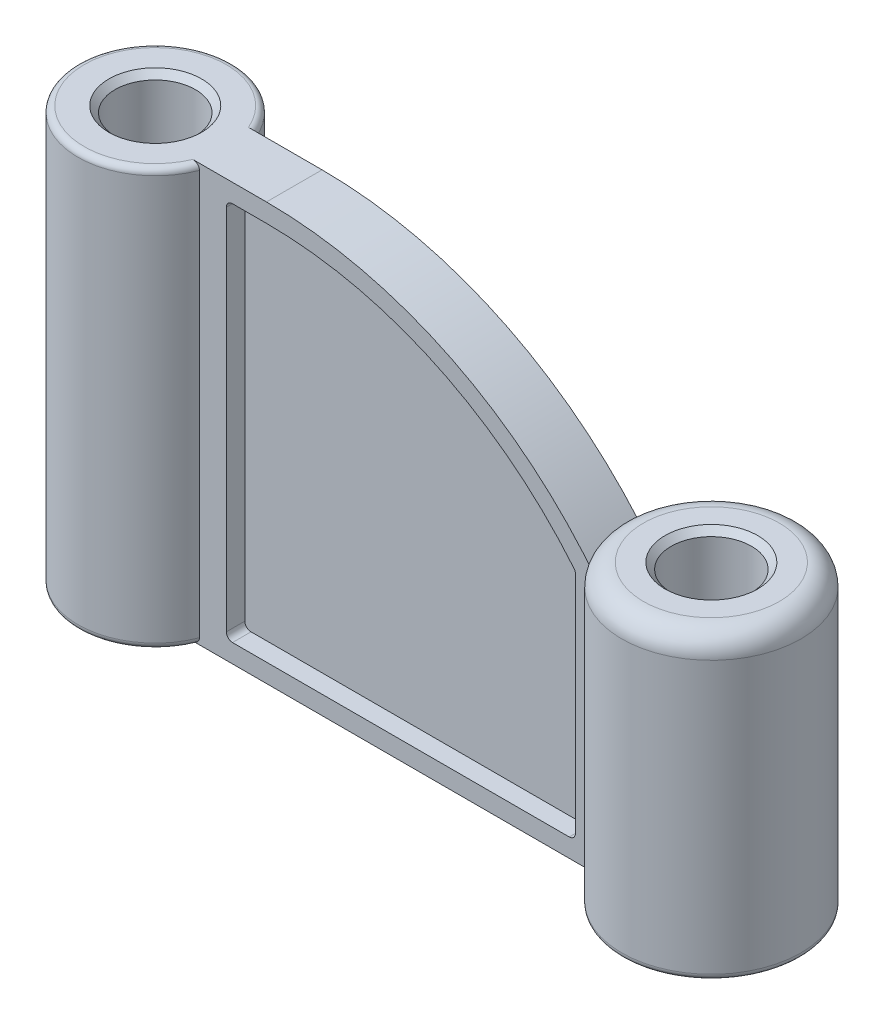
SolidWorks part; units mm, degrees
ref_plane "Front Plane" through (0, 0, 0) normal (0, 0, 1) x (1, 0, 0)
ref_plane "Top Plane" through (0, 0, 0) normal (0, 1, 0) x (1, 0, 0)
ref_plane "Right Plane" through (0, 0, 0) normal (1, 0, 0) x (0, 0, -1)
sketch "Sketch1" plane through (0, 0, 0) normal (0, 1, 0) x (1, 0, 0)
  line L0 (0, 0) -> (89.422, 0) construction
  line L1 (23.3238, -9) -> (152.4319, -9)
  line L2 (23.3238, 9) -> (152.4319, 9)
  line L3 (0, 9) -> (180, 9) construction
  line L4 (0, -9) -> (180, -9) construction
  line L5 (0, 0) -> (180, 0) construction
  circle A0 centre (0, 0) radius 13
  arc A1 (23.3238, 9) -> (23.3238, -9) centre (0, 0) ccw
  arc A2 (152.4319, -9) -> (152.4319, 9) centre (180, 0) ccw
  circle A3 centre (180, 0) radius 13
  dimension "D1" = 50
  dimension "D" = 26
  dimension "B" = 58
  dimension "D2" = 9
  dimension "C" = 180
  dimension "D3" = 9
extrude "Boss-Extrude1" add sketch "Sketch1" along normal blind 135
sketch "Sketch2" plane through (0, 0, 9) normal (0, 0, 1) x (1, 0, 0)
  line L0 (13, 135) -> (-13, 135) construction
  line L1 (13, 135) -> (-13, 135) construction
  line L2 (193, 135) -> (167, 135) construction
  line L3 (193, 135) -> (167, 135) construction
  line L4 (0, 135) -> (0, -18.572) construction
  line L5 (180, 135) -> (180, -26.9551) construction
  line L6 (45, 135) -> (45, 0) construction
  line L7 (23.3238, 0) -> (152.4319, 0) construction
  line L8 (23.3238, 135) -> (152.4319, 135) construction
  line L9 (152.4319, 135) -> (152.4319, 0) construction
  line L10 (152.4319, 81.752) -> (152.4319, 0) construction
  line L11 (152.4319, 0) -> (23.3238, 0) construction
  line L12 (23.3238, 0) -> (23.3238, 135) construction
  line L13 (23.3238, 135) -> (45, 135)
  line L14 (152.4319, 81.752) -> (152.4319, 171.4438)
  line L15 (152.4319, 171.4438) -> (23.3238, 171.4438)
  line L16 (23.3238, 171.4438) -> (23.3238, 135)
  arc A0 (45, 135) -> (152.4319, 81.752) centre (45, 0) cw
  dimension "D1" = 135
sketch "Sketch3" plane through (0, 0, 0) normal (0, 0, 1) x (1, 0, 0)
  line L0 (23.3238, 0) -> (152.4319, 0) construction
  line L1 (152.4319, 0) -> (209, 0) construction
  line L2 (23.3238, 0) -> (152.4319, 0) construction
  line L3 (152.4319, 0) -> (209, 0) construction
  line L4 (180.716, 0) -> (180, 97) construction
  line L5 (180, 135) -> (180, -26.9551) construction
  line L6 (209, 97) -> (152.4319, 97)
  line L7 (209, 0) -> (209, 135) construction
  line L8 (152.4319, 135) -> (152.4319, 0) construction
  line L9 (152.4319, 97) -> (152.4319, 197)
  line L10 (152.4319, 197) -> (209, 197)
  line L11 (209, 197) -> (209, 97)
  dimension "D1" = 100
  dimension "Y" = 97
extrude "Cut-Extrude2" cut sketch "Sketch2" against normal through all
extrude "Cut-Extrude3" cut sketch "Sketch3" against normal through all and the other way through all
sketch "Sketch4" plane through (0, 97, 0) normal (0, 1, 0) x (1, 0, 0)
  circle A1 centre (180, 0) radius 29
  circle A2 centre (180, 0) radius 13 construction
  circle A3 centre (180, 0) radius 13
extrude "Boss-Extrude2" add sketch "Sketch4" against normal up to next
sketch "Sketch5" plane through (0, 0, 9) normal (0, 0, 1) x (1, 0, 0)
  line L0 (193, 97) -> (167, 97) construction
  line L1 (193, 97) -> (167, 97)
  line L2 (13, 135) -> (-13, 135) construction
  line L3 (13, 135) -> (-13, 135)
  line L4 (0, 135) -> (0, 0) construction
  line L5 (180, 97) -> (180, 0) construction
  line L6 (32, 129) -> (32, 6)
  line L7 (145, 81.4923) -> (145, 6)
  line L13 (23.3238, 129) -> (45, 129)
  line L14 (32, 129) -> (45, 129)
  line L15 (-25, 0) -> (23.3238, 0) construction
  line L16 (23.3238, 6) -> (152.4319, 6)
  line L17 (32, 6) -> (145, 6)
  line L18 (152.4319, 0) -> (209, 0) construction
  arc A5 (147.6572, 78.1186) -> (45, 129) centre (45, 0) ccw
  arc A6 (145, 81.4923) -> (45, 129) centre (45, 0) ccw
  dimension "D1" = 32
  dimension "D2" = 35
  dimension "D3" = 6
  dimension "D4" = 6
extrude "Cut-Extrude4" cut sketch "Sketch5" against normal blind 6 contours A6 L14 L6 L17 L7
mirror "Mirror1" about plane through (0, 0, 0) normal (0, 0, 1) of "Cut-Extrude4"
chamfer "Chamfer1" distance 2 angle 45 4 edges at (180, 0, 13) (0, 0, 13) (193, 97, 0) (0, 135, 13)
fillet "Fillet1" radius 7 1 edges at (209, 97, 0)
fillet "Fillet2" radius 2 11 edges at (32, 6, -6) (145, 6, -6) (145, 81.4923, -6) (32, 129, -6) (32, 129, 6) (145, 81.4923, 6) (145, 6, 6) (32, 6, 6) (209, 0, 0) (-25, 0, 0) (-25, 135, 0)
equation "\"A\"= 135"
equation "\"B\"= 58"
equation "\"C\"= 180"
equation "\"D\"= 26"
equation "\"Y\"= 1.5 * \"B\" + 10"
